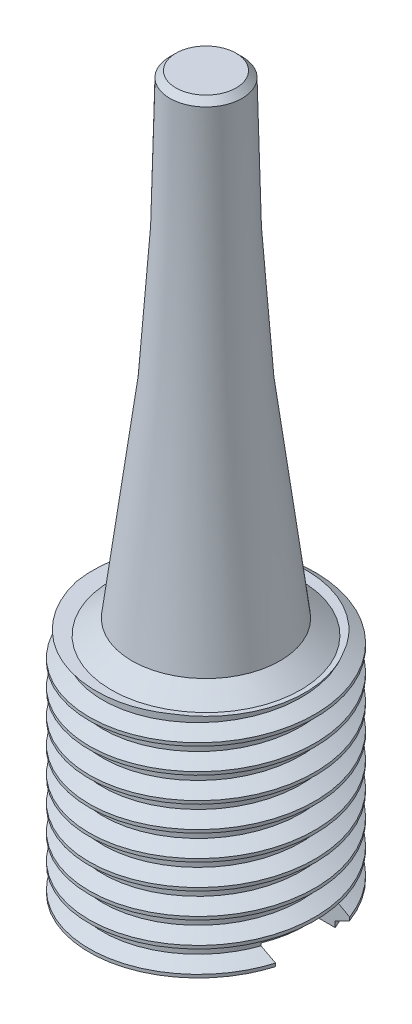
SolidWorks part; units mm, degrees
ref_plane "Front" through (0, 0, 0) normal (0, 0, 1) x (1, 0, 0)
ref_plane "Top" through (0, 0, 0) normal (0, 1, 0) x (1, 0, 0)
ref_plane "Right" through (0, 0, 0) normal (1, 0, 0) x (0, 0, -1)
sketch "Sketch2" plane through (0, 0, 0) normal (0, 0, 1) x (1, 0, 0)
  line L0 (0, -9.525) -> (4.7625, -9.525)
  line L1 (4.7625, -9.525) -> (4.7625, 0)
  line L2 (4.7625, 0) -> (0, 0)
  line L3 (0, 0) -> (0, -9.525)
  line L4 (0, 0) -> (0, 20.6375)
  line L5 (0, -9.525) -> (13.5002, -9.525) construction
  line L6 (0, 3.175) -> (9.7234, 3.175) construction
  line L7 (0, -9.525) -> (0, -29.2326) construction
  line L8 (0, 20.6375) -> (98.6211, 20.6375) construction
  line L9 (0, 20.6375) -> (1.524, 20.6375)
  arc A2 (1.524, 20.6375) -> (3.2256, 0) centre (127.5222, 20.6375) ccw
  dimension "D6" = 1.524
  dimension "D7" = 125.9982
  dimension "D1" = 4.7625
  dimension "D2" = 9.525
  dimension "D3" = 12.7
  dimension "D4" = 3.175
  dimension "D5" = 30.1625
revolve "Revolve1" add sketch "Sketch2" angle 360 about L4
thread "Thread1" pitch 1.0583 start angle 0, offset 2.54, length 13.97, pitch 1.0583, diameter 9.525
ref_plane "Plane1" through (4.7625, -12.065, 0) normal (0, 0, 1) x (1, 0, 0)
sketch "Thread Profile1" plane through (4.7625, -12.065, 0) normal (0, 0, 1) x (1, 0, 0)
  line L0 (0, 0) -> (0, 1.0583) construction
  line L11 (0, 0) -> (0, 0.926)
  line L12 (0, 0.926) -> (-0.5728, 0.5953)
  line L13 (-0.5728, 0.5953) -> (-0.5728, 0.3307)
  line L15 (-0.5728, 0.3307) -> (0, 0)
  line L17 (-0.5728, 0.463) -> (0, 0.463) construction
  point P2 (0, 0)
  dimension "Pitch" = 1.0583
  dimension "Profile_Angle" = 60
  dimension "Profile_Land" = 0.2646
  dimension "Profile_Height" = 0.5728
chamfer "Chamfer2" distance 0.254 angle 45 1 edges at (0, 20.6375, -1.524)
chamfer "Chamfer3" distance 0.635 angle 45 1 edges at (0, 0, -3.2256)
sketch "Sketch3" plane through (0, 0, 0) normal (1, 0, 0) x (0, 0, -1)
  line L0 (0, 0) -> (0, -11.1059) construction
  line L1 (-3.5797, -9.525) -> (2.1769, -9.525) construction
  line L2 (1.5654, -8.5196) -> (-1.5654, -8.5196)
  line L3 (1.5654, -8.5196) -> (1.5654, -9.525)
  line L4 (1.5654, -9.525) -> (-1.5654, -9.525)
  line L5 (-1.5654, -8.5196) -> (-1.5654, -9.525)
  line L6 (1.5654, -8.5196) -> (-1.5654, -9.525) construction
  line L7 (1.5654, -9.525) -> (-1.5654, -8.5196) construction
  spline S0 degree 2 number of poles 147 (-0.7636, -9.525) -> (-0.7636, 0) construction
  point P3 (0, -9.0223)
extrude "Cut-Extrude1" cut sketch "Sketch3" against normal through all both and the other way through all contours L2 L5 L4 L3
